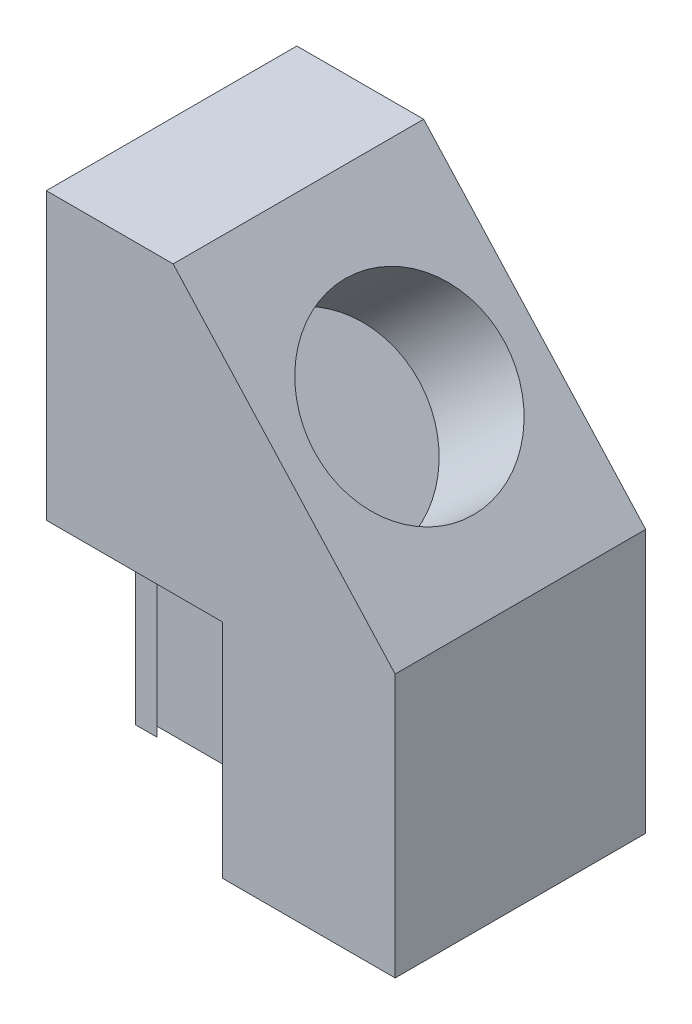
SolidWorks part; units mm, degrees
ref_plane "Front" through (0, 0, 0) normal (0, 0, 1) x (1, 0, 0)
ref_plane "Top" through (0, 0, 0) normal (0, 1, 0) x (1, 0, 0)
ref_plane "Right" through (0, 0, 0) normal (1, 0, 0) x (0, 0, -1)
sketch "Sketch1" plane through (0, 0, 0) normal (0, 0, 1) x (1, 0, 0)
  line L0 (50.8, 203.2) -> (139.7, 105.41)
  line L1 (0, 203.2) -> (50.8, 203.2)
  line L2 (0, 203.2) -> (0, 0)
  line L3 (0, 0) -> (139.7, 0)
  line L4 (139.7, 105.41) -> (139.7, 0)
  dimension "D1" = 203.2
  dimension "D2" = 50.8
  dimension "D3" = 105.41
  dimension "D4" = 139.7
extrude "Extrude1" add sketch "Sketch1" along normal mid plane 100.33
sketch "Sketch2" plane through (128.9538, 117.2308, 0) normal (0.7399, 0.6727, 0) x (0, 0, -1)
  line L0 (50.165, 116.184) -> (-50.165, -15.9753) construction
  circle A0 centre (0, 50.1044) radius 38.1
  dimension "D1" = 76.2
extrude "Cut-Extrude1" cut sketch "Sketch2" against normal blind 45.974
sketch "Sketch3" plane through (0, 0, 50.165) normal (0, 0, 1) x (1, 0, 0)
  line L1 (0, 0) -> (70.5681, 0)
  line L2 (0, 0) -> (0, 88.9)
  line L3 (0, 88.9) -> (70.5681, 88.9)
  line L4 (70.5681, 0) -> (70.5681, 88.9)
  dimension "D1" = 88.9
extrude "Cut-Extrude2" cut sketch "Sketch3" against normal blind 35.814
sketch "Sketch4" plane through (0, 0, 0) normal (0, -1, 0) x (1, 0, 0)
  line L0 (35.284, 14.351) -> (35.284, -18.1188) construction
  line L1 (0, 14.351) -> (70.5681, 14.351) construction
  line L2 (61.954, 14.351) -> (65.764, 10.541)
  line L3 (65.764, 10.541) -> (4.804, 10.541)
  line L4 (8.614, 14.351) -> (4.804, 10.541)
  line L5 (8.614, 14.351) -> (61.954, 14.351)
  point P8 (35.284, 10.541)
  dimension "D1" = 45
  dimension "D2" = 3.81
  dimension "D3" = 60.96
extrude "Cut-Extrude3" cut sketch "Sketch4" against normal up to surface (88.9 mm away)
